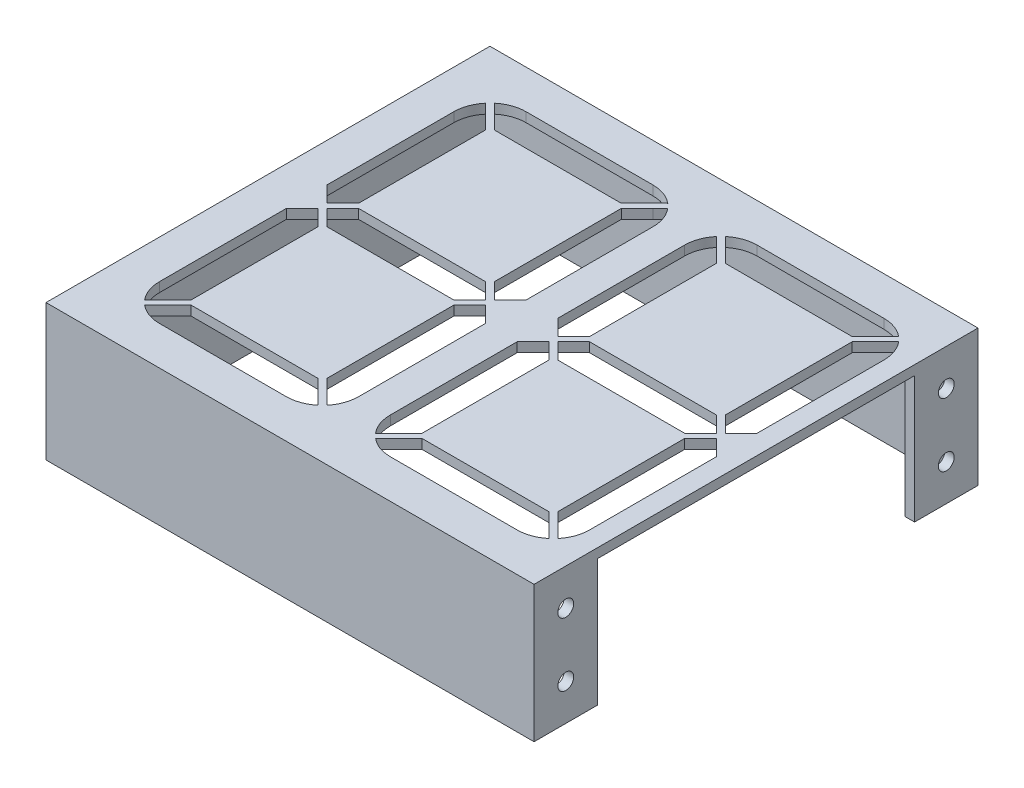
SolidWorks part; units mm, degrees
ref_plane "Alzado" through (0, 0, 0) normal (0, 0, 1) x (1, 0, 0)
ref_plane "Planta" through (0, 0, 0) normal (0, 1, 0) x (1, 0, 0)
ref_plane "Vista lateral" through (0, 0, 0) normal (1, 0, 0) x (0, 0, -1)
sketch "Croquis2" plane through (0, 0, 0) normal (0, 1, 0) x (1, 0, 0)
  line L0 (-16.41, 5) -> (-56.41, 5)
  line L2 (-11.41, 0) -> (-16.41, -5)
  line L3 (-56.41, -5) -> (-16.41, -5)
  line L4 (-16.41, 5) -> (-11.41, 0)
  line L5 (-56.41, 5) -> (-61.41, 0)
  line L6 (-61.41, 0) -> (-56.41, -5)
  line L9 (-14.9958, 6.4142) -> (-9.9958, 1.4142)
  line L11 (-4.9931, 6.41) -> (-4.9931, 46.4031)
  line L13 (-9.9958, 51.4127) -> (-14.9958, 46.4127)
  line L14 (-14.9958, 46.4127) -> (-14.9958, 6.4142)
  line L18 (-57.8242, 46.4127) -> (-57.8242, 6.4142)
  line L19 (-62.8242, 51.4127) -> (-57.8242, 46.4127)
  line L21 (-67.8235, 6.4135) -> (-67.8235, 46.4135)
  line L23 (-57.8242, 6.4142) -> (-62.8242, 1.4142)
  line L29 (-14.9958, -6.4073) -> (-9.9958, -1.4073)
  line L31 (-57.8172, -6.4142) -> (-62.8172, -1.4142)
  line L33 (-67.8165, -6.4135) -> (-67.8165, -46.4135)
  line L35 (-62.8172, -51.4127) -> (-57.8172, -46.4127)
  line L36 (-57.8172, -46.4127) -> (-57.8172, -6.4142)
  line L37 (-14.9958, -46.4058) -> (-14.9958, -6.4073)
  line L38 (-9.9958, -51.4058) -> (-14.9958, -46.4058)
  line L40 (-4.9965, -6.4135) -> (-4.9965, -46.4065)
  line L43 (-11.41, -52.82) -> (-16.41, -47.82)
  line L46 (-61.41, -52.82) -> (-56.41, -47.82)
  line L47 (-56.41, -47.82) -> (-16.41, -47.82)
  line L48 (-16.41, -57.82) -> (-56.4099, -57.82)
  line L49 (-16.4169, 47.82) -> (-11.4169, 52.82)
  line L56 (-56.4169, 47.82) -> (-61.4169, 52.82)
  line L57 (-56.4169, 57.82) -> (-16.41, 57.82)
  line L58 (-16.4169, 47.82) -> (-56.4169, 47.82)
  line L84 (-9.9958, 51.4127) -> (-7.6639, 53.7414)
  line L86 (-11.4169, 52.82) -> (-9.0786, 55.1551)
  line L88 (-61.4169, 52.82) -> (-63.7486, 55.1517)
  line L90 (-62.8242, 51.4127) -> (-65.1558, 53.7443)
  line L100 (-61.41, -52.82) -> (-63.7416, -55.1516)
  line L102 (-62.8172, -51.4127) -> (-65.1488, -53.7443)
  line L104 (-11.41, -52.82) -> (-9.0772, -55.1528)
  line L106 (-9.9958, -51.4058) -> (-7.663, -53.7385)
  line L108 (-62.8242, 1.4142) -> (-67.8235, 6.4135)
  line L109 (-62.8172, -1.4142) -> (-67.8165, -6.4135)
  line L110 (-9.9958, 1.4142) -> (-4.9931, 6.41)
  line L111 (-9.9958, -1.4073) -> (-4.9965, -6.4135)
  line L112 (-3.0433, 70) -> (-3.0433, -70) construction
  line L113 (9.9958, -1.4073) -> (4.9965, -6.4135)
  line L114 (9.9958, 1.4142) -> (4.9931, 6.41)
  line L115 (62.8172, -1.4142) -> (67.8165, -6.4135)
  line L116 (62.8242, 1.4142) -> (67.8235, 6.4135)
  line L117 (9.9958, -51.4058) -> (7.663, -53.7385)
  line L118 (11.41, -52.82) -> (9.0772, -55.1528)
  line L119 (62.8172, -51.4127) -> (65.1488, -53.7443)
  line L120 (61.41, -52.82) -> (63.7416, -55.1516)
  line L121 (62.8242, 51.4127) -> (65.1558, 53.7443)
  line L122 (61.4169, 52.82) -> (63.7486, 55.1517)
  line L123 (11.4169, 52.82) -> (9.0786, 55.1551)
  line L124 (9.9958, 51.4127) -> (7.6639, 53.7414)
  line L125 (16.4169, 47.82) -> (56.4169, 47.82)
  line L126 (56.4169, 57.82) -> (16.41, 57.82)
  line L127 (56.4169, 47.82) -> (61.4169, 52.82)
  line L128 (16.4169, 47.82) -> (11.4169, 52.82)
  line L129 (16.41, -57.82) -> (56.4099, -57.82)
  line L130 (56.41, -47.82) -> (16.41, -47.82)
  line L131 (61.41, -52.82) -> (56.41, -47.82)
  line L132 (11.41, -52.82) -> (16.41, -47.82)
  line L133 (4.9965, -6.4135) -> (4.9965, -46.4065)
  line L134 (9.9958, -51.4058) -> (14.9958, -46.4058)
  line L135 (14.9958, -46.4058) -> (14.9958, -6.4073)
  line L136 (57.8172, -46.4127) -> (57.8172, -6.4142)
  line L137 (62.8172, -51.4127) -> (57.8172, -46.4127)
  line L138 (67.8165, -6.4135) -> (67.8165, -46.4135)
  line L139 (57.8172, -6.4142) -> (62.8172, -1.4142)
  line L140 (14.9958, -6.4073) -> (9.9958, -1.4073)
  line L141 (57.8242, 6.4142) -> (62.8242, 1.4142)
  line L142 (67.8235, 6.4135) -> (67.8235, 46.4135)
  line L143 (62.8242, 51.4127) -> (57.8242, 46.4127)
  line L144 (57.8242, 46.4127) -> (57.8242, 6.4142)
  line L145 (14.9958, 46.4127) -> (14.9958, 6.4142)
  line L146 (9.9958, 51.4127) -> (14.9958, 46.4127)
  line L147 (4.9931, 6.41) -> (4.9931, 46.4031)
  line L148 (14.9958, 6.4142) -> (9.9958, 1.4142)
  line L149 (61.41, 0) -> (56.41, -5)
  line L150 (56.41, 5) -> (61.41, 0)
  line L151 (16.41, 5) -> (11.41, 0)
  line L152 (56.41, -5) -> (16.41, -5)
  line L153 (11.41, 0) -> (16.41, -5)
  line L154 (16.41, 5) -> (56.41, 5)
  line L155 (-3.0433, 0) -> (-80, 0) construction
  line L156 (-3.0433, 0) -> (73.9135, 0) construction
  line L157 (67.8235, 26.4135) -> (73.9135, 26.4135) construction
  line L158 (-80, 0) -> (-80, 70)
  line L162 (-80, -70) -> (-80, 0)
  line L163 (-80, 70) -> (73.9135, 70)
  line L164 (73.9135, 70) -> (73.9135, -70)
  line L165 (73.9135, -70) -> (-80, -70)
  arc A0 (-16.41, -57.82) -> (-9.0772, -55.1528) centre (-16.41, -46.4065) ccw
  arc A1 (-67.8165, -46.4135) -> (-65.1488, -53.7443) centre (-56.4099, -46.4134) ccw
  arc A2 (-67.8235, 46.4135) -> (-65.1558, 53.7443) centre (-56.4169, 46.4135) cw
  arc A3 (-16.41, 57.82) -> (-9.0786, 55.1551) centre (-16.41, 46.4031) cw
  arc A4 (-63.7486, 55.1517) -> (-56.4169, 57.82) centre (-56.4169, 46.4135) cw
  arc A5 (-7.6639, 53.7414) -> (-4.9931, 46.4031) centre (-16.41, 46.4031) cw
  arc A6 (-63.7416, -55.1516) -> (-56.4099, -57.82) centre (-56.4099, -46.4134) ccw
  arc A7 (-7.663, -53.7385) -> (-4.9965, -46.4065) centre (-16.41, -46.4065) ccw
  arc A8 (7.663, -53.7385) -> (4.9965, -46.4065) centre (16.41, -46.4065) cw
  arc A9 (63.7416, -55.1516) -> (56.4099, -57.82) centre (56.4099, -46.4134) cw
  arc A10 (7.6639, 53.7414) -> (4.9931, 46.4031) centre (16.41, 46.4031) ccw
  arc A11 (63.7486, 55.1517) -> (56.4169, 57.82) centre (56.4169, 46.4135) ccw
  arc A12 (16.41, 57.82) -> (9.0786, 55.1551) centre (16.41, 46.4031) ccw
  arc A13 (67.8235, 46.4135) -> (65.1558, 53.7443) centre (56.4169, 46.4135) ccw
  arc A14 (67.8165, -46.4135) -> (65.1488, -53.7443) centre (56.4099, -46.4134) cw
  arc A15 (16.41, -57.82) -> (9.0772, -55.1528) centre (16.41, -46.4065) cw
extrude "Saliente-Extruir4" add sketch "Croquis2" along normal blind 3
sketch "Croquis3" plane through (0, 0, 0) normal (0, -1, 0) x (-1, 0, 0)
  line L0 (80, -70) -> (77, -70) construction
  line L1 (80, -70) -> (-73.9135, -70)
  line L2 (80, -70) -> (80, 70)
  line L3 (80, 70) -> (-73.9135, 70)
  line L4 (-73.9135, -70) -> (-73.9135, -50)
  line L5 (77, -70) -> (77, -67) construction
  line L6 (77, -67) -> (80, -67) construction
  line L7 (-73.9135, 70) -> (-70.9135, 70) construction
  line L8 (-70.9135, 70) -> (-70.9135, 67) construction
  line L9 (-70.9135, 67) -> (-73.9135, 67) construction
  line L10 (-70.9135, 70) -> (-70.9135, 50) construction
  line L11 (-70.9135, 67) -> (77, 67)
  line L12 (-70.9135, 67) -> (-70.9135, 50)
  line L13 (-70.9135, -67) -> (77, -67)
  line L14 (77, 67) -> (77, -67)
  line L15 (-70.9135, 50) -> (-73.9135, 50)
  line L16 (-70.9135, -70) -> (-70.9135, -50) construction
  line L17 (-70.9135, -50) -> (-73.9135, -50)
  line L18 (-73.9135, 50) -> (-73.9135, 70)
  line L19 (-70.9135, -50) -> (-70.9135, -67)
extrude "Saliente-Extruir5" add sketch "Croquis3" along normal blind 40
sketch "Croquis4" plane through (73.9135, 0, 0) normal (1, 0, 0) x (0, 0, -1)
  line L0 (-70, -18.5) -> (-60, -18.5) construction
  line L1 (-70, 3) -> (-70, -40) construction
  line L2 (-60, -18.5) -> (-60, -8.5) construction
  line L3 (-60, -18.5) -> (-60, -28.5) construction
  line L4 (70, -18.5) -> (60, -18.5) construction
  line L5 (70, 3) -> (70, -40) construction
  line L6 (60, -18.5) -> (60, -8.5) construction
  line L7 (60, -18.5) -> (60, -28.5) construction
  circle A0 centre (-60, -8.5) radius 2.5
  circle A1 centre (-60, -28.5) radius 2.5
  circle A2 centre (60, -8.5) radius 2.5
  circle A3 centre (60, -28.5) radius 2.5
extrude "Cortar-Extruir2" cut sketch "Croquis4" against normal blind 3
